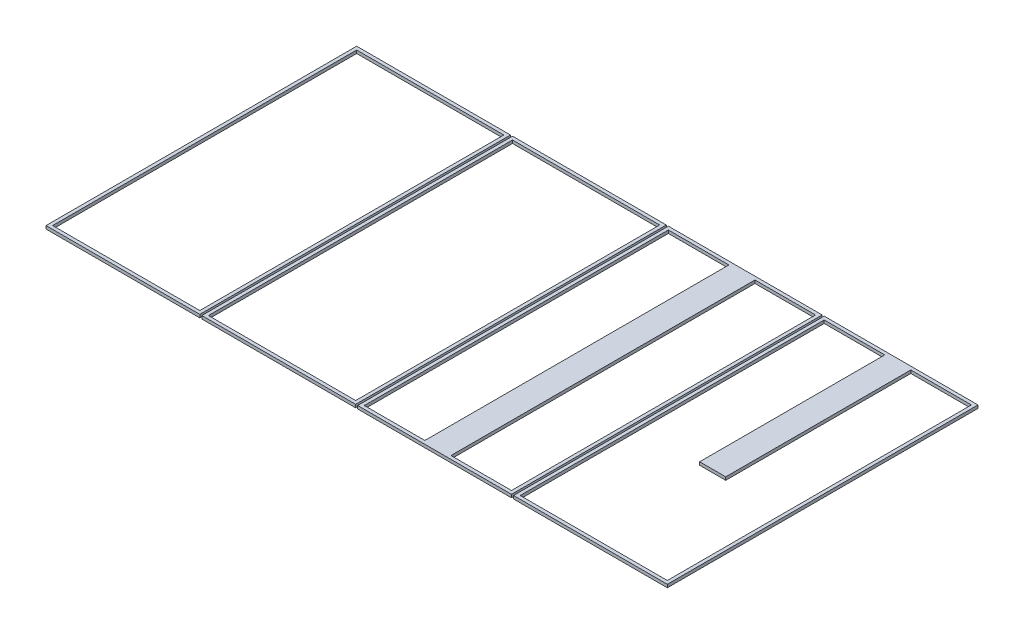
SolidWorks part; units mm, degrees
ref_plane "Front Plane" through (0, 0, 0) normal (0, 0, 1) x (1, 0, 0)
ref_plane "Top Plane" through (0, 0, 0) normal (0, 1, 0) x (1, 0, 0)
ref_plane "Right Plane" through (0, 0, 0) normal (1, 0, 0) x (0, 0, -1)
sketch "Sketch1" plane through (0, 0, 0) normal (0, 1, 0) x (1, 0, 0)
  line L0 (21.5, 1198.5) -> (582.5, 1198.5) construction
  line L2 (0, 0) -> (0, 1220)
  line L3 (0, 1220) -> (604, 1220)
  line L4 (2440, 0) -> (2440, 1220)
  line L5 (13, 1207) -> (591, 1207)
  line L9 (582.5, 1198.5) -> (582.5, 21.5) construction
  line L10 (13, 1207) -> (13, 13)
  line L11 (13, 13) -> (591, 13)
  line L12 (591, 1207) -> (591, 13)
  line L13 (625, 1207) -> (1203, 1207)
  line L14 (625, 1207) -> (625, 13)
  line L15 (625, 13) -> (1203, 13)
  line L16 (1203, 1207) -> (1203, 13)
  line L17 (0, 0) -> (13, 0)
  line L18 (13, 0) -> (591, 0)
  line L19 (591, 0) -> (604, 0)
  line L20 (625, 0) -> (1203, 0)
  line L21 (1237, 13) -> (1815, 13)
  line L22 (1237, 13) -> (1237, 1207)
  line L23 (1237, 1207) -> (1815, 1207)
  line L24 (1815, 13) -> (1815, 1207)
  line L25 (604, 0) -> (612, 0) construction
  line L26 (1237, 0) -> (1815, 0)
  line L27 (612, 0) -> (625, 0)
  line L28 (1849, 0) -> (2427, 0)
  line L29 (2427, 0) -> (2440, 0)
  line L30 (21.5, 21.5) -> (582.5, 21.5) construction
  line L31 (1849, 1207) -> (2427, 1207)
  line L32 (1849, 1207) -> (1849, 13)
  line L33 (1849, 13) -> (2427, 13)
  line L34 (2427, 1207) -> (2427, 13)
  line L35 (21.5, 1198.5) -> (21.5, 21.5) construction
  line L36 (633.5, 1198.5) -> (1194.5, 1198.5) construction
  line L37 (1194.5, 1198.5) -> (1194.5, 21.5) construction
  line L38 (633.5, 21.5) -> (1194.5, 21.5) construction
  line L39 (633.5, 1198.5) -> (633.5, 21.5) construction
  line L40 (1245.5, 1198.5) -> (1806.5, 1198.5) construction
  line L41 (1806.5, 21.5) -> (1806.5, 1198.5) construction
  line L42 (1245.5, 21.5) -> (1806.5, 21.5) construction
  line L43 (1245.5, 21.5) -> (1245.5, 1198.5) construction
  line L44 (1857.5, 1198.5) -> (1857.5, 21.5) construction
  line L45 (1857.5, 21.5) -> (2418.5, 21.5) construction
  line L46 (2418.5, 1198.5) -> (2418.5, 21.5) construction
  line L47 (1857.5, 1198.5) -> (2418.5, 1198.5) construction
  line L48 (1203, 0) -> (1216, 0)
  line L49 (1216, 0) -> (1224, 0) construction
  line L50 (1224, 0) -> (1237, 0)
  line L51 (1815, 0) -> (1828, 0)
  line L52 (1828, 0) -> (1836, 0) construction
  line L53 (1836, 0) -> (1849, 0)
  line L54 (604, 0) -> (604, 1220)
  line L55 (612, 0) -> (612, 1220)
  line L56 (1216, 0) -> (1216, 1220)
  line L57 (1224, 0) -> (1224, 1220)
  line L58 (1828, 0) -> (1828, 1220)
  line L59 (1836, 0) -> (1836, 1220)
  line L60 (612, 1220) -> (1216, 1220)
  line L61 (604, 1220) -> (612, 1220) construction
  line L62 (1224, 1220) -> (1828, 1220)
  line L63 (1216, 1220) -> (1224, 1220) construction
  line L64 (1836, 1220) -> (2440, 1220)
  line L65 (1828, 1220) -> (1836, 1220) construction
extrude "Boss.-Extru.1" add sketch "Sketch1" along normal blind 12
sketch "Sketch2" plane through (0, 0, 0) normal (0, 1, 0) x (1, 0, 0)
  line L0 (1815, 1207) -> (1237, 1207) construction
  line L1 (1474.8, 1207) -> (1577.2, 1207)
  line L2 (1474.8, 1207) -> (1474.8, 13)
  line L3 (1474.8, 13) -> (1577.2, 13)
  line L4 (1577.2, 1207) -> (1577.2, 13)
  line L5 (1237, 13) -> (1815, 13) construction
  line L6 (2427, 1207) -> (1849, 1207) construction
  line L7 (2086.8, 1207) -> (2189.2, 1207)
  line L8 (2086.8, 1207) -> (2086.8, 480.1)
  line L9 (2086.8, 480.1) -> (2189.2, 480.1)
  line L10 (2189.2, 1207) -> (2189.2, 480.1)
  line L11 (1466.3, 1191.5) -> (1466.3, 1151.9495) construction
  line L12 (1585.7, 1191.5) -> (1585.7, 1151.9495) construction
  line L13 (2078.3, 1191.5) -> (2078.3, 1151.9495) construction
  line L14 (2197.7, 1191.5) -> (2197.7, 1151.9495) construction
  line L15 (1920.9495, 471.6) -> (2347.0505, 471.6) construction
extrude "Boss-Extrude1" add sketch "Sketch2" along normal blind 12
sketch "Sketch3" plane through (-0.25, 0, 0) normal (0, 1, 0) x (1, 0, 0)
  line L0 (352.95, 962.3333) -> (13.25, 962.3333)
  line L1 (352.95, 917.0606) -> (352.95, 1007.6061) construction
  line L2 (13.25, 1207) -> (13.25, 13) construction
  line L3 (352.95, 962.3333) -> (1245.75, 962.3333)
  line L4 (1245.75, 1125.0505) -> (1245.75, 94.9495) construction
  line L5 (1466.55, 912) -> (1857.75, 912)
  line L6 (1466.55, 974.0505) -> (1466.55, 849.9495) construction
  line L7 (1857.75, 1125.0505) -> (1857.75, 564.7272) construction
  line L8 (2078.55, 962.3333) -> (2427.25, 962.3333)
  line L9 (2078.55, 1007.6061) -> (2078.55, 917.0606) construction
  line L10 (2427.25, 13) -> (2427.25, 1207) construction
  line L11 (352.95, 257.6667) -> (13.25, 257.6667)
  line L12 (352.95, 302.9394) -> (352.95, 212.3939) construction
  line L13 (352.95, 257.6667) -> (1245.75, 257.6667)
  line L14 (1466.55, 308) -> (1857.75, 308)
  line L15 (1466.55, 245.9495) -> (1466.55, 370.0505) construction
  line L16 (1857.75, 257.8) -> (1857.75, 464.6) construction
  line L17 (2308.35, 1207) -> (2308.35, 13)
  line L25 (1696.35, 1207) -> (1696.35, 13)
  line L26 (1815.25, 1207) -> (1577.45, 1207) construction
  line L27 (1577.45, 13) -> (1815.25, 13) construction
  line L29 (2427.25, 1207) -> (2189.45, 1207) construction
  line L30 (1849.25, 13) -> (2427.25, 13) construction
  line L31 (1968.15, 1207) -> (1968.15, 13)
  line L32 (2087.05, 1207) -> (1849.25, 1207) construction
  line L33 (1356.15, 1207) -> (1356.15, 13)
  line L34 (1475.05, 1207) -> (1237.25, 1207) construction
  line L35 (1237.25, 13) -> (1475.05, 13) construction
  line L36 (1084.35, 1207) -> (1084.35, 13)
  line L37 (1203.25, 1207) -> (625.25, 1207) construction
  line L38 (625.25, 13) -> (1203.25, 13) construction
  line L39 (1187.75, 21.5) -> (980.95, 21.5) construction
  line L40 (854.55, 1207) -> (854.55, 13)
  line L41 (799.35, 81.5) -> (909.75, 81.5) construction
  line L42 (799.35, 81.6327) -> (799.35, 81.3673) construction
  line L43 (909.75, 81.3673) -> (909.75, 81.6327) construction
  line L44 (472.35, 1207) -> (472.35, 13)
  line L45 (591.25, 1207) -> (13.25, 1207) construction
  line L46 (13.25, 13) -> (591.25, 13) construction
  line L47 (187.35, 1138.5) -> (297.75, 1138.5) construction
  line L48 (187.35, 1138.3673) -> (187.35, 1138.6327) construction
  line L49 (297.75, 1138.6327) -> (297.75, 1138.3673) construction
  line L50 (242.55, 1207) -> (242.55, 13)
  line L51 (575.75, 1198.5) -> (368.95, 1198.5) construction
  point P62 (1084.35, 21.5)
  point P71 (854.55, 81.5)
  point P86 (242.55, 1138.5)
  point P89 (472.35, 1198.5)
extrude "Extrude-Thin1" [suppressed] add sketch "Sketch3" along normal blind 3 thin
equation "\"D12@Sketch1\"=\"tool_diameter\""
equation "\"tool_diameter\"=8"
equation "\"clearance_tight\"=0.1"
equation "\"material_thickness\"=12"
equation "\"D1@Boss.-Extru.1\"=\"material_thickness\""
equation "\"D5@Sketch1\"=\"tool_diameter\" + \"clearance_loose\""
equation "\"D6@Sketch1\"=\"D5@Sketch1\""
equation "\"clearance_loose\"=0.5"
equation "\"tab_thickness\" = 25"
equation "\"tab_height\" = 3"
equation "\"D1@Boss-Extrude1\"=\"material_thickness\""
equation "\"D1@Sketch2\"=\"tool_diameter\" + \"clearance_loose\""
equation "\"D2@Sketch2\"=\"tool_diameter\" + \"clearance_loose\""
equation "\"D3@Sketch2\"=\"tool_diameter\" + \"clearance_loose\""
equation "\"D5@Sketch2\"=\"tool_diameter\" + \"clearance_loose\""
equation "\"D4@Sketch2\"= \"tool_diameter\" + \"clearance_loose\""
equation "\"D1@Extrude-Thin1\"=\"tab_height\""
equation "\"D5@Extrude-Thin1\"=\"tab_thickness\""
